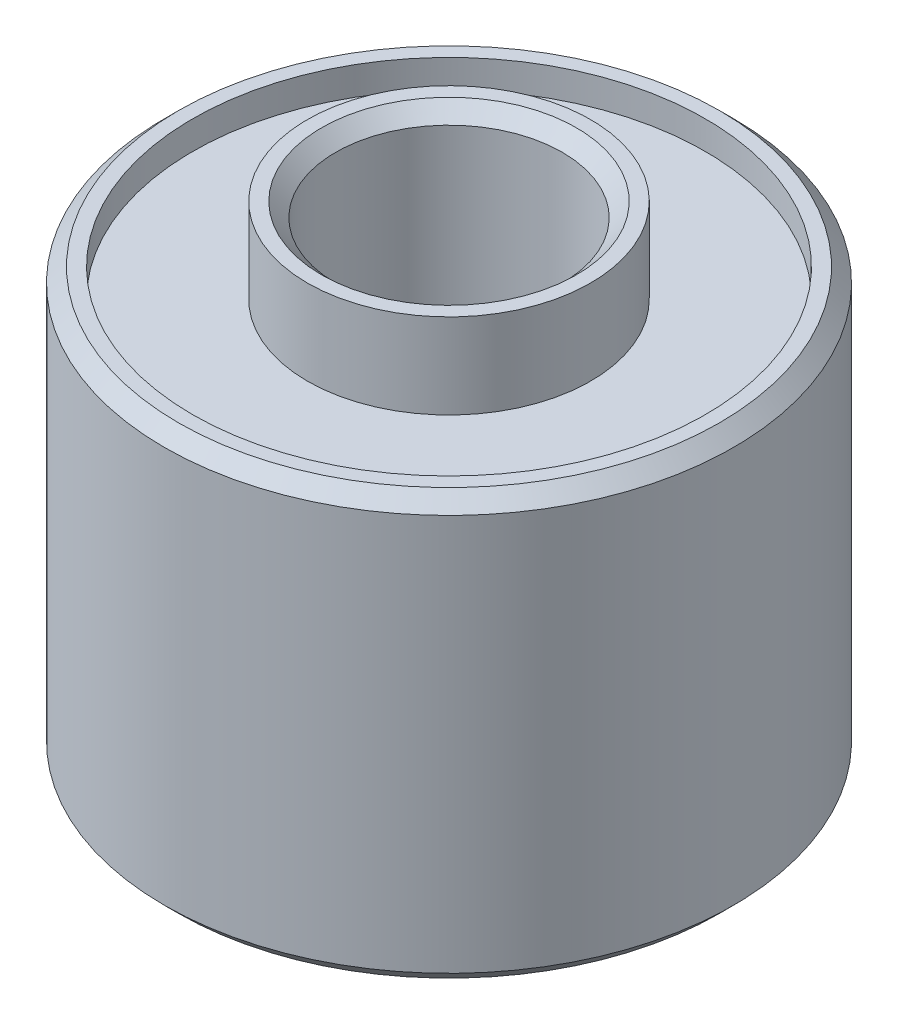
SolidWorks part; units mm, degrees
ref_plane "Plan1" through (0, 0, 0) normal (0, 0, 1) x (1, 0, 0)
ref_plane "Plan2" through (0, 0, 0) normal (0, 1, 0) x (1, 0, 0)
ref_plane "Plan3" through (0, 0, 0) normal (1, 0, 0) x (0, 0, -1)
sketch "Esquisse1" plane through (0, 0, 0) normal (0, 0, 1) x (1, 0, 0)
  line L0 (0, 0) -> (0, -9.5) construction
  line L1 (-4, 9) -> (-4, -9)
  line L2 (-4, 9) -> (-4.5, 9.5)
  line L3 (-4.5, 9.5) -> (-5, 9.5)
  line L4 (-5, 9.5) -> (-5, 6.5)
  line L5 (-5, 6.5) -> (-9.05, 6.5)
  line L6 (-9.05, 6.5) -> (-9.05, 7.5)
  line L7 (-9.05, 7.5) -> (-9.55, 7.5)
  line L8 (-9.55, 7.5) -> (-10.05, 7)
  line L9 (-10.05, 7) -> (-10.05, -7)
  line L10 (0, 0) -> (-15.6, 0) construction
  line L11 (-9.55, -7.5) -> (-10.05, -7)
  line L12 (-9.05, -7.5) -> (-9.55, -7.5)
  line L13 (-9.05, -6.5) -> (-9.05, -7.5)
  line L14 (-5, -6.5) -> (-9.05, -6.5)
  line L15 (-5, -9.5) -> (-5, -6.5)
  line L16 (-4.5, -9.5) -> (-5, -9.5)
  line L17 (-4, -9) -> (-4.5, -9.5)
  point P16 (-10.05, 0)
  point P23 (-4, 0)
  dimension "D1" = 20.1
  dimension "D2" = 1
  dimension "D3" = 0.5
  dimension "D4" = 45
  dimension "D5" = 1
  dimension "D6" = 0.5
  dimension "D7" = 45
  dimension "D8" = 8
  dimension "D9" = 19
  dimension "D10" = 15
  dimension "D11" = 13
revolve "Base-Révolution" add sketch "Esquisse1" angle 360 about L0
